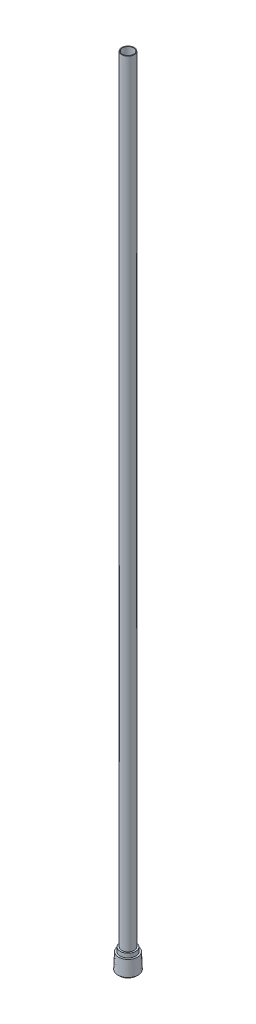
SolidWorks part; units mm, degrees
ref_plane "Front Plane" through (0, 0, 0) normal (0, 0, 1) x (1, 0, 0)
ref_plane "Top Plane" through (0, 0, 0) normal (0, 1, 0) x (1, 0, 0)
ref_plane "Right Plane" through (0, 0, 0) normal (1, 0, 0) x (0, 0, -1)
sketch "Sketch1" plane through (0, 0, 0) normal (1, 0, 0) x (0, 0, -1)
  line L0 (0, 304.8) -> (0, 0)
  line L1 (2.9845, 6.35) -> (2.9845, 7.9248)
  line L2 (2.9845, 7.9248) -> (2.3749, 7.9248)
  line L5 (3.8989, 0) -> (3.6674, 6.35)
  line L6 (0, 0) -> (3.8989, 0)
  line L7 (3.6674, 6.35) -> (2.9845, 6.35)
  line L8 (2.3749, 7.9248) -> (2.3749, 304.8)
  line L9 (2.3749, 304.8) -> (0, 304.8)
  line L10 (0, 0) -> (0, -49989.3417) construction
  dimension "D1" = 2.088
  dimension "PH" = 6.35
  dimension "L" = 304.8
  dimension "OD" = 4.7498
  dimension "NPT" = 7.7978
  dimension "SH-D" = 5.969
  dimension "SH" = 7.9248
revolve "Revolve1" add sketch "Sketch1" angle 360 about L10
sketch "Sketch3" plane through (0, 0, 0) normal (0, -1, 0) x (-1, 0, 0)
  line L0 (0, 4.2691) -> (0, -4.2691) construction
  line L1 (0, -2.2877) -> (1.9812, -1.1438)
  line L2 (1.9812, -1.1438) -> (1.9812, 1.1438)
  line L3 (1.9812, 1.1438) -> (0, 2.2877)
  line L4 (0, 2.2877) -> (-1.9812, 1.1438)
  line L5 (-1.9812, 1.1438) -> (-1.9812, -1.1438)
  line L6 (-1.9812, -1.1438) -> (0, -2.2877)
  circle A0 centre (0, 0) radius 1.9812 construction
  dimension "HEX" = 3.9624
extrude "Cut-Extrude2" cut sketch "Sketch3" against normal blind 3.9624
sketch "Sketch2" plane through (0, 304.8, 0) normal (0, 1, 0) x (1, 0, 0)
  circle A0 centre (0, 0) radius 2.1209
  dimension "ID" = 4.2418
extrude "Cut-Extrude1" cut sketch "Sketch2" against normal up to surface (300.8376 mm away)
chamfer "Chamfer1" distance 0.508 angle 45 1 edges at (0, 0, 3.8989)
